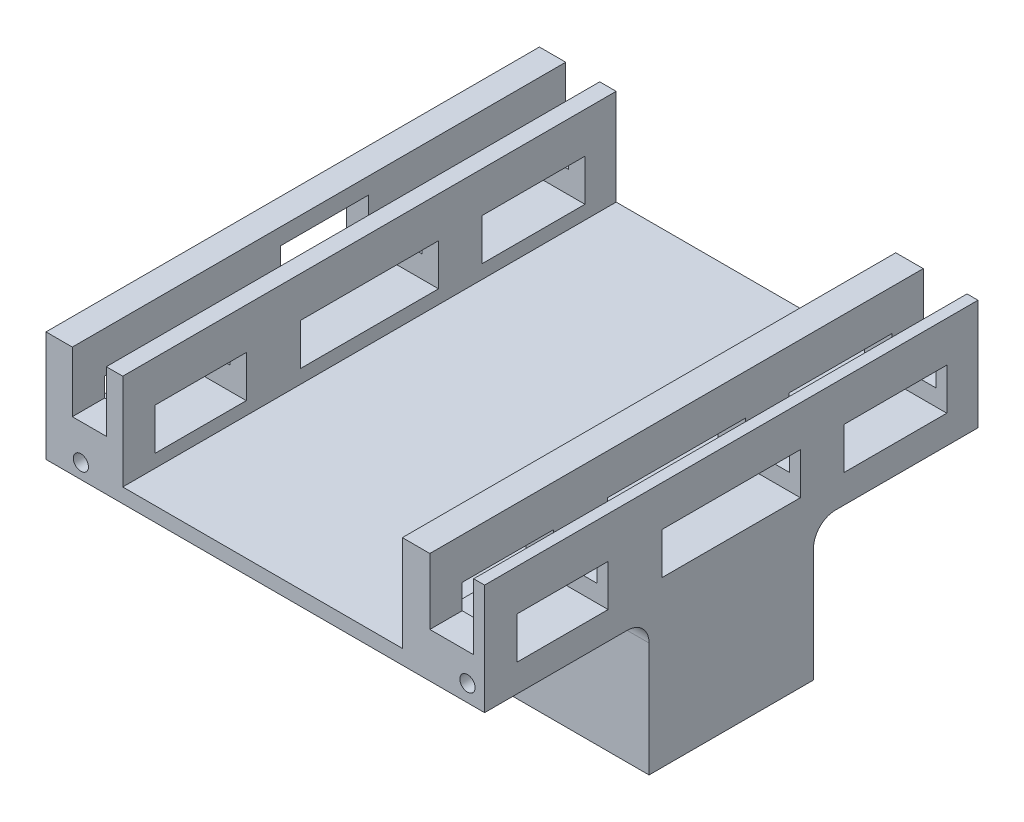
SolidWorks part; units mm, degrees
ref_plane "Front Plane" through (0, 0, 0) normal (0, 0, 1) x (1, 0, 0)
ref_plane "Top Plane" through (0, 0, 0) normal (0, 1, 0) x (1, 0, 0)
ref_plane "Right Plane" through (0, 0, 0) normal (1, 0, 0) x (0, 0, -1)
sketch "Sketch1" plane through (0, 0, 0) normal (0, 0, 1) x (1, 0, 0)
  line L1 (0, 0) -> (50.8, 0)
  line L2 (0, 0) -> (0, 19.05)
  line L3 (0, 19.05) -> (50.8, 19.05)
  line L4 (50.8, 0) -> (50.8, 19.05)
extrude "Boss-Extrude1" add sketch "Sketch1" along normal blind 19.05
sketch "Sketch3" plane through (0, 0, 19.05) normal (0, 0, 1) x (1, 0, 0)
  circle A0 centre (12.7, 9.525) radius 3.175
extrude "Cut-Extrude1" cut sketch "Sketch3" against normal through all
sketch "Sketch4" plane through (0, 0, 19.05) normal (0, 0, 1) x (1, 0, 0)
  circle A0 centre (38.1, 9.525) radius 3.1302
extrude "Cut-Extrude3" cut sketch "Sketch4" against normal through all
sketch "Sketch6" plane through (0, 19.05, 0) normal (0, 1, 0) x (1, 0, 0)
  line L0 (50.8, 0) -> (0, 0) construction
  line L1 (7.62, 0) -> (43.18, 0)
  line L2 (7.62, 0) -> (7.62, -19.05)
  line L3 (7.62, -19.05) -> (43.18, -19.05)
  line L4 (43.18, 0) -> (43.18, -19.05)
  line L5 (50.8, -19.05) -> (0, -19.05) construction
extrude "Boss-Extrude2" add sketch "Sketch6" along normal blind 9.525
sketch "Sketch7" plane through (0, 0, 19.05) normal (0, 0, 1) x (1, 0, 0)
  line L1 (43.18, 28.575) -> (7.62, 28.575)
  line L2 (43.18, 28.575) -> (43.18, 15.7766)
  line L3 (43.18, 15.7766) -> (7.62, 15.7766)
  line L4 (7.62, 28.575) -> (7.62, 15.7766)
extrude "Boss-Extrude3" add sketch "Sketch7" along normal blind 19.05 and the other way blind 38.1
sketch "Sketch8" plane through (43.18, 0, 0) normal (1, 0, 0) x (0, 0, -1)
  line L1 (-34.3529, 18.9651) -> (-23.7898, 18.9651)
  line L2 (-34.3529, 18.9651) -> (-34.3529, 23.8023)
  line L3 (-34.3529, 23.8023) -> (-23.7898, 23.8023)
  line L4 (-23.7898, 18.9651) -> (-23.7898, 23.8023)
extrude "Cut-Extrude4" cut sketch "Sketch8" against normal blind 37.846
sketch "Sketch9" plane through (7.62, 0, 0) normal (-1, 0, 0) x (0, 0, 1)
  line L1 (-15.4356, 19.05) -> (-3.5236, 19.05)
  line L2 (-15.4356, 19.05) -> (-15.4356, 23.876)
  line L3 (-15.4356, 23.876) -> (-3.5236, 23.876)
  line L4 (-3.5236, 19.05) -> (-3.5236, 23.876)
extrude "Cut-Extrude5" cut sketch "Sketch9" against normal blind 37.846
sketch "Sketch10" plane through (0, 0, -19.05) normal (0, 0, -1) x (-1, 0, 0)
  line L1 (-40.132, 26.0365) -> (-26.924, 26.0365)
  line L2 (-40.132, 26.0365) -> (-40.132, 18.221)
  line L3 (-40.132, 18.221) -> (-26.924, 18.221)
  line L4 (-26.924, 26.0365) -> (-26.924, 18.221)
  line L5 (-23.876, 26.0365) -> (-10.668, 26.0365)
  line L6 (-23.876, 26.0365) -> (-23.876, 18.221)
  line L7 (-23.876, 18.221) -> (-10.668, 18.221)
  line L8 (-10.668, 26.0365) -> (-10.668, 18.221)
extrude "Cut-Extrude6" cut sketch "Sketch10" against normal blind 204.724
sketch "Sketch12" plane through (43.18, 0, 0) normal (1, 0, 0) x (0, 0, -1)
  line L1 (-38.1, 28.575) -> (19.05, 28.575)
  line L2 (-38.1, 28.575) -> (-38.1, 15.7766)
  line L3 (-38.1, 15.7766) -> (19.05, 15.7766)
  line L4 (19.05, 28.575) -> (19.05, 15.7766)
  line L5 (-34.3529, 23.8023) -> (-23.7898, 23.8023)
  line L6 (-34.3529, 23.8023) -> (-34.3529, 18.9651)
  line L7 (-34.3529, 18.9651) -> (-23.7898, 18.9651)
  line L8 (-23.7898, 23.8023) -> (-23.7898, 18.9651)
  line L9 (3.5236, 23.876) -> (15.4356, 23.876)
  line L10 (3.5236, 23.876) -> (3.5236, 19.05)
  line L11 (3.5236, 19.05) -> (15.4356, 19.05)
  line L12 (15.4356, 23.876) -> (15.4356, 19.05)
extrude "Boss-Extrude4" add sketch "Sketch12" along normal blind 7.62
sketch "Sketch13" plane through (7.62, 0, 0) normal (-1, 0, 0) x (0, 0, 1)
  line L0 (-15.4356, 23.876) -> (-15.4356, 19.05) construction
  line L1 (-19.05, 28.575) -> (38.1, 28.575)
  line L2 (-19.05, 28.575) -> (-19.05, 15.7766)
  line L3 (-19.05, 15.7766) -> (38.1, 15.7766)
  line L4 (38.1, 28.575) -> (38.1, 15.7766)
  line L5 (23.7898, 23.8023) -> (34.3529, 23.8023)
  line L6 (23.7898, 23.8023) -> (23.7898, 18.9651)
  line L7 (23.7898, 18.9651) -> (34.3529, 18.9651)
  line L8 (34.3529, 23.8023) -> (34.3529, 18.9651)
  line L9 (-3.5236, 19.05) -> (-15.4356, 19.05)
  line L10 (-3.5236, 19.05) -> (-3.5236, 23.876)
  line L11 (-3.5236, 23.876) -> (-15.4356, 23.876)
  line L12 (-15.4356, 19.05) -> (-15.4356, 23.876)
extrude "Boss-Extrude5" add sketch "Sketch13" along normal blind 7.62
sketch "Sketch14" plane through (50.8, 0, 0) normal (1, 0, 0) x (0, 0, -1)
  line L1 (-17.526, 19.05) -> (-1.524, 19.05)
  line L2 (-17.526, 19.05) -> (-17.526, 23.876)
  line L3 (-17.526, 23.876) -> (-1.524, 23.876)
  line L4 (-1.524, 19.05) -> (-1.524, 23.876)
extrude "Cut-Extrude7" cut sketch "Sketch14" against normal through all and the other way through all
sketch "Sketch15" plane through (0, 28.575, 0) normal (0, 1, 0) x (1, 0, 0)
  line L0 (50.8, -38.1) -> (0, -38.1) construction
  line L1 (46.99, -38.1) -> (8.89, -38.1)
  line L2 (46.99, -38.1) -> (46.99, 19.05)
  line L3 (46.99, 19.05) -> (8.89, 19.05)
  line L4 (8.89, -38.1) -> (8.89, 19.05)
  line L5 (50.8, 19.05) -> (0, 19.05) construction
extrude "Cut-Extrude9" cut sketch "Sketch15" against normal blind 11.1125
sketch "Sketch16" plane through (0, 28.575, 0) normal (0, 1, 0) x (1, 0, 0)
  line L0 (50.8, 19.05) -> (46.99, 19.05) construction
  line L1 (49.53, 19.05) -> (48.26, 19.05)
  line L2 (49.53, 19.05) -> (49.53, -38.1)
  line L3 (49.53, -38.1) -> (48.26, -38.1)
  line L4 (48.26, 19.05) -> (48.26, -38.1)
  line L5 (50.8, -38.1) -> (46.99, -38.1) construction
extrude "Cut-Extrude10" cut sketch "Sketch16" against normal blind 7.62
sketch "Sketch17" plane through (0, 0, 38.1) normal (0, 0, 1) x (1, 0, 0)
  line L0 (8.89, 28.575) -> (0, 28.575) construction
  line L1 (6.985, 28.575) -> (3.048, 28.575)
  line L2 (6.985, 28.575) -> (6.985, 21.59)
  line L3 (6.985, 21.59) -> (3.048, 21.59)
  line L4 (3.048, 28.575) -> (3.048, 21.59)
extrude "Cut-Extrude12" cut sketch "Sketch17" against normal through all
sketch "Sketch18" plane through (0, 0, 0) normal (-1, 0, 0) x (0, 0, 1)
  line L1 (1.524, 23.876) -> (17.526, 23.876)
  line L2 (1.524, 23.876) -> (1.524, 19.05)
  line L3 (1.524, 19.05) -> (17.526, 19.05)
  line L4 (17.526, 23.876) -> (17.526, 19.05)
extrude "Boss-Extrude6" add sketch "Sketch18" against normal blind 3.048
sketch "Sketch19" plane through (0, 0, 0) normal (-1, 0, 0) x (0, 0, 1)
  line L1 (3.81, 26.67) -> (13.97, 26.67)
  line L2 (3.81, 26.67) -> (3.81, 20.32)
  line L3 (3.81, 20.32) -> (13.97, 20.32)
  line L4 (13.97, 26.67) -> (13.97, 20.32)
extrude "Cut-Extrude13" cut sketch "Sketch19" against normal blind 4.7625
fillet "Fillet1" radius 2.54 1 edges at (25.4, 15.7766, 0)
fillet "Fillet3" radius 2.54 1 edges at (25.4, 15.7766, 19.05)
sketch "Sketch21" plane through (0, 0, 0) normal (-1, 0, 0) x (0, 0, 1)
  line L1 (3.81, 26.67) -> (0.1587, 26.67)
  line L2 (3.81, 26.67) -> (3.81, 20.32)
  line L3 (3.81, 20.32) -> (0.1588, 20.32)
  line L4 (0.1587, 26.67) -> (0.1588, 20.32)
extrude "Cut-Extrude14" cut sketch "Sketch21" against normal blind 0.508
sketch "Sketch22" plane through (0, 0, 0) normal (-1, 0, 0) x (0, 0, 1)
  line L1 (13.97, 20.32) -> (17.9387, 20.32)
  line L2 (13.97, 20.32) -> (13.97, 26.6844)
  line L3 (13.97, 26.6844) -> (17.9387, 26.6844)
  line L4 (17.9387, 20.32) -> (17.9387, 26.6844)
extrude "Cut-Extrude15" cut sketch "Sketch22" against normal blind 0.508
sketch "Sketch23" plane through (0, 0, 38.1) normal (0, 0, 1) x (1, 0, 0)
  circle A0 centre (48.8209, 17.7297) radius 0.8844
extrude "Cut-Extrude16" cut sketch "Sketch23" against normal blind 5.08
sketch "Sketch24" plane through (0, 0, 38.1) normal (0, 0, 1) x (1, 0, 0)
  circle A0 centre (4.0375, 17.4876) radius 0.8804
extrude "Cut-Extrude17" cut sketch "Sketch24" against normal blind 5.08
sketch "Sketch25" plane through (0, 0, 19.05) normal (0, 0, 1) x (1, 0, 0)
  circle A0 centre (12.7, 9.525) radius 3.4925
  circle A1 centre (38.1, 9.525) radius 3.4925
extrude "Cut-Extrude18" cut sketch "Sketch25" against normal through all
sketch "Sketch26" plane through (46.99, 0, 0) normal (-1, 0, 0) x (0, 0, 1)
  line L0 (38.1, 17.4625) -> (38.1, 28.575) construction
  line L1 (-19.05, 17.4625) -> (38.1, 17.4625)
  line L2 (-19.05, 17.4625) -> (-19.05, 28.575)
  line L3 (-19.05, 28.575) -> (38.1, 28.575)
  line L4 (38.1, 17.4625) -> (38.1, 28.575)
extrude "Boss-Extrude8" add sketch "Sketch26" along normal blind 12.192
sketch "Sketch28" plane through (0, 0, 38.1) normal (0, 0, 1) x (1, 0, 0)
  line L0 (48.26, 28.575) -> (34.798, 28.575) construction
  line L1 (8.89, 17.4625) -> (41.275, 17.4625)
  line L2 (8.89, 17.4625) -> (8.89, 28.575)
  line L3 (8.89, 28.575) -> (41.275, 28.575)
  line L4 (41.275, 17.4625) -> (41.275, 28.575)
extrude "Cut-Extrude19" cut sketch "Sketch28" against normal blind 68.58
sketch "Sketch29" plane through (0, 0, 38.1) normal (0, 0, 1) x (1, 0, 0)
  line L1 (49.53, 28.575) -> (44.4586, 28.575)
  line L2 (49.53, 28.575) -> (49.53, 20.955)
  line L3 (49.53, 20.955) -> (44.4586, 20.955)
  line L4 (44.4586, 28.575) -> (44.4586, 20.955)
extrude "Cut-Extrude20" cut sketch "Sketch29" against normal blind 68.58
sketch "Sketch30" plane through (50.8, 0, 0) normal (1, 0, 0) x (0, 0, -1)
  line L1 (-34.3529, 23.8023) -> (-23.7898, 23.8023)
  line L2 (-34.3529, 23.8023) -> (-34.3529, 18.9651)
  line L3 (-34.3529, 18.9651) -> (-23.7898, 18.9651)
  line L4 (-23.7898, 23.8023) -> (-23.7898, 18.9651)
  line L5 (-17.526, 23.876) -> (-1.524, 23.876)
  line L6 (-17.526, 23.876) -> (-17.526, 19.05)
  line L7 (-17.526, 19.05) -> (-1.524, 19.05)
  line L8 (-1.524, 23.876) -> (-1.524, 19.05)
  line L9 (3.5236, 23.876) -> (15.4356, 23.876)
  line L10 (3.5236, 23.876) -> (3.5236, 19.05)
  line L11 (3.5236, 19.05) -> (15.4356, 19.05)
  line L12 (15.4356, 23.876) -> (15.4356, 19.05)
extrude "Cut-Extrude21" cut sketch "Sketch30" against normal blind 12.7
sketch "Sketch31" plane through (0, 0, 0) normal (0, 0, -1) x (-1, 0, 0)
  circle A0 centre (-38.1, 9.525) radius 3.4925
  circle A1 centre (-38.1, 9.525) radius 3.302
extrude "Boss-Extrude10" add sketch "Sketch31" against normal blind 19.05
sketch "Sketch32" plane through (0, 0, 0) normal (0, 0, -1) x (-1, 0, 0)
  circle A0 centre (-12.7, 9.525) radius 3.4925
  circle A1 centre (-12.7, 9.525) radius 3.302
extrude "Boss-Extrude12" add sketch "Sketch32" against normal blind 19.05
